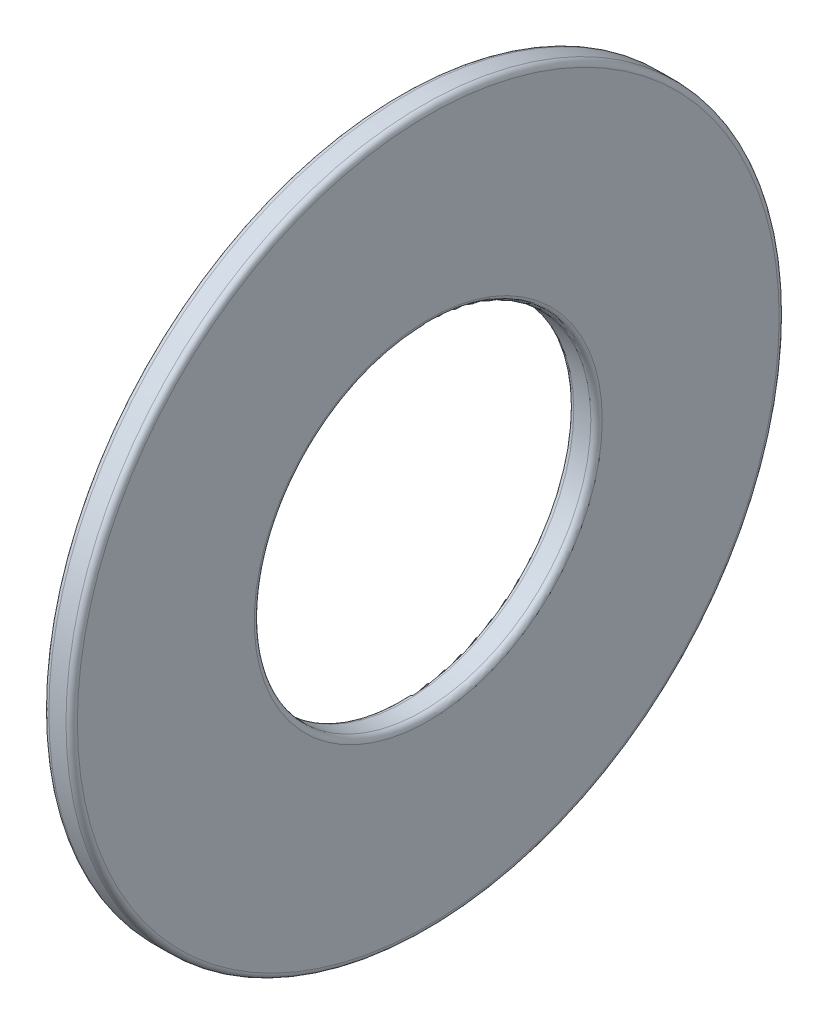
SolidWorks part; units mm, degrees
ref_plane "Front Plane" through (0, 0, 0) normal (0, 0, 1) x (1, 0, 0)
ref_plane "Top Plane" through (0, 0, 0) normal (0, 1, 0) x (1, 0, 0)
ref_plane "Right Plane" through (0, 0, 0) normal (1, 0, 0) x (0, 0, -1)
sketch "Sketch3" plane through (0, 0, 0) normal (0, 0, 1) x (1, 0, 0)
  line L0 (-1.143, 0) -> (1.143, 0) construction
  line L1 (0, -28.575) -> (0, 28.575) construction
  line L2 (0, -13.4874) -> (0, 13.4874) construction
  line L4 (1.143, -28.575) -> (-1.143, -28.575)
  line L5 (1.143, -28.575) -> (1.143, 28.575)
  line L6 (1.143, 28.575) -> (-1.143, 28.575)
  line L7 (-1.143, -28.575) -> (-1.143, 28.575)
  line L8 (0, 28.575) -> (0, -28.575) construction
  line L9 (1.143, 0) -> (-1.143, 0) construction
  point P0 (0, 0)
  point P4 (0, 0)
  point P8 (0, 0)
  point P11 (0, 0)
sketch "Sketch1" plane through (0, 0, 0) normal (1, 0, 0) x (0, 0, -1)
  circle A0 centre (0, 0) radius 28.575
  circle A1 centre (0, 0) radius 13.4874
extrude "Boss-Extrude1" add sketch "Sketch1" along normal mid plane 2.286
fillet "Fillet1" radius 0.4572 4 edges at (1.143, 0, -28.575) (-1.143, 0, -28.575) (1.143, 0, -13.4874) (-1.143, 0, -13.4874)
sketch "Sketch4" plane through (-1.143, 0, 0) normal (-1, 0, 0) x (0, 0, 1)
  line L0 (0, -28.575) -> (0, 28.575) construction
  line L1 (0, -28.575) -> (0, 28.575) construction
  circle A0 centre (0, 0) radius 13.4874 construction
  circle A1 centre (0, 0) radius 28.575 construction
  circle A2 centre (0, 0) radius 13.4874 construction
  circle A3 centre (0, 0) radius 28.575 construction
  point P0 (0, -13.4874)
  point P1 (0, 13.4874)
  point P5 (-28.575, 0)
  point P9 (-13.4874, 0)
  point P10 (13.4874, 0)
  point P11 (28.575, 0)
equation "\"D1@Boss-Extrude1\" = \"Thickness@Sketch3\""
equation "\"D1@Fillet1\"=\"Thickness@Sketch3\"*.2"
